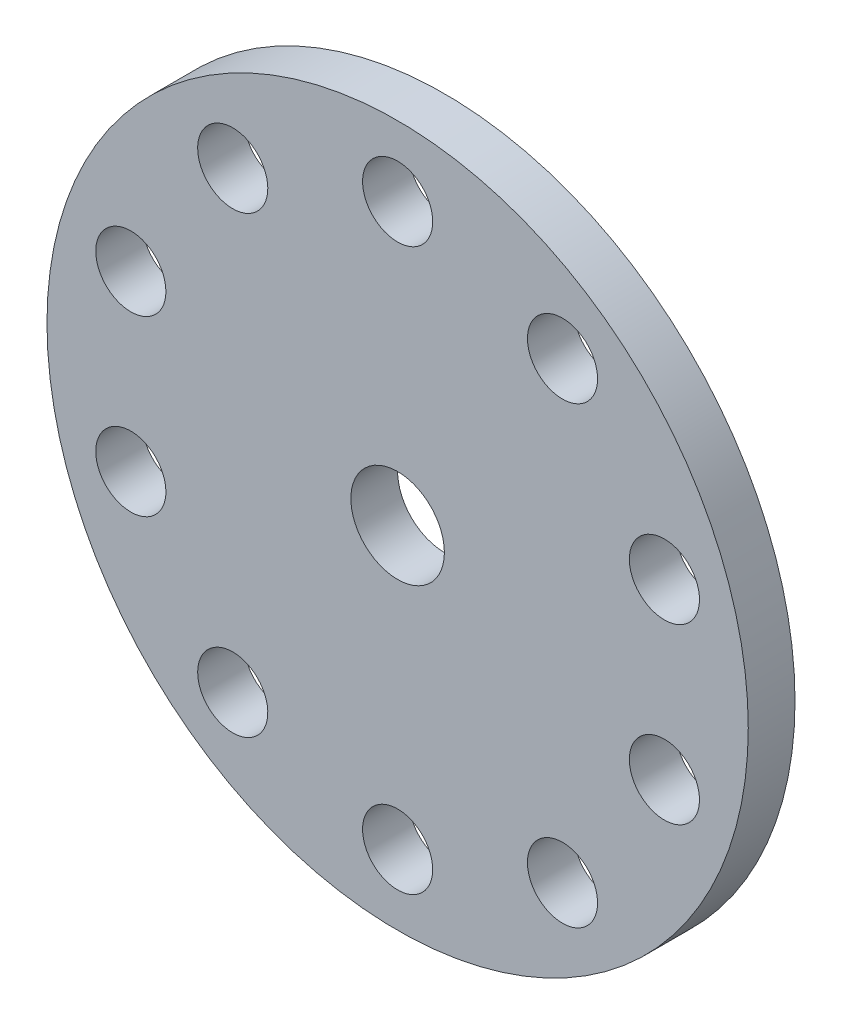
SolidWorks part; units mm, degrees
ref_plane "Płaszczyzna przednia" through (0, 0, 0) normal (0, 0, 1) x (1, 0, 0)
ref_plane "Płaszczyzna górna" through (0, 0, 0) normal (0, 1, 0) x (1, 0, 0)
ref_plane "Płaszczyzna prawa" through (0, 0, 0) normal (1, 0, 0) x (0, 0, -1)
sketch "Szkic1" plane through (0, 0, 0) normal (0, 0, 1) x (1, 0, 0)
  circle A0 centre (0, 0) radius 20
  circle A1 centre (0, 0) radius 150
  dimension "D1" = 40
  dimension "D2" = 300
extrude "Dodanie-wyciągnięcie1" add sketch "Szkic1" along normal blind 20
sketch "Szkic2" plane through (0, 0, 20) normal (0, 0, 1) x (1, 0, 0)
  circle A0 centre (0, 0) radius 120 construction
  circle A1 centre (0, 120) radius 15
  dimension "D1" = 240
  dimension "D2" = 30
extrude "Wytnij-wyciągnięcie1" cut sketch "Szkic2" against normal through all
pattern_circular "Szyk kołowy1" count 10 over 360 about axis through (0, 0, 0) along (0, 0, 1) of "Wytnij-wyciągnięcie1"
